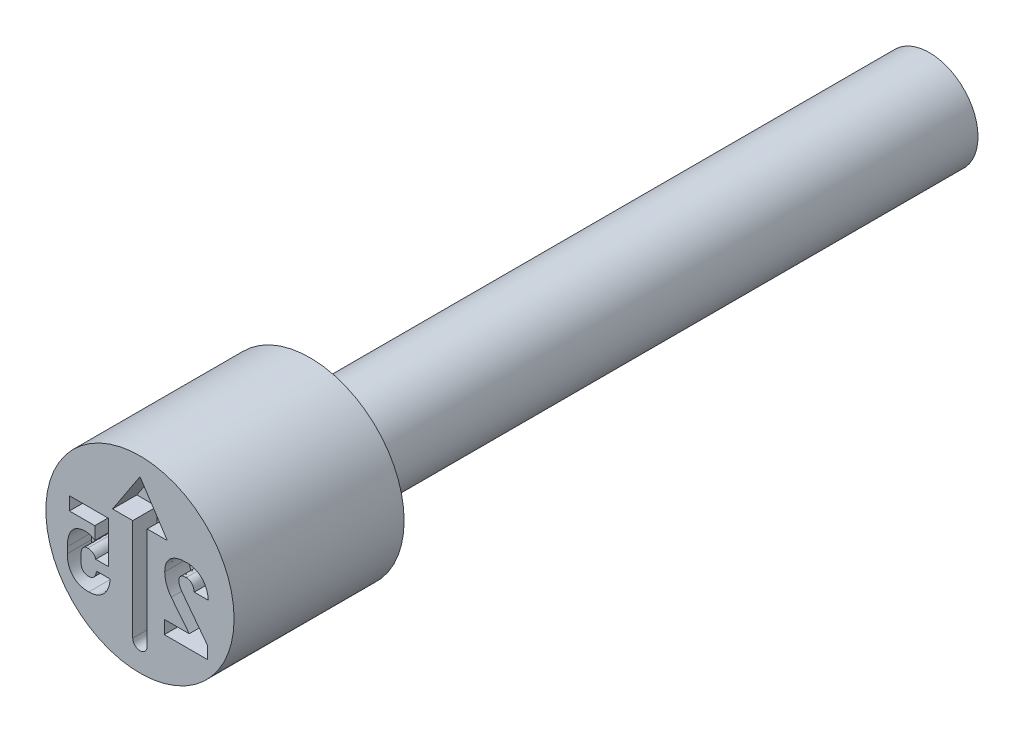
SolidWorks part; units mm, degrees
ref_plane "Front Plane" through (0, 0, 0) normal (0, 0, 1) x (1, 0, 0)
ref_plane "Top Plane" through (0, 0, 0) normal (0, 1, 0) x (1, 0, 0)
ref_plane "Right Plane" through (0, 0, 0) normal (1, 0, 0) x (0, 0, -1)
sketch "Sketch2" plane through (0, 0, 0) normal (1, 0, 0) x (0, 0, -1)
  line L0 (0.4039, 0) -> (50000.4039, 0) construction
  line L6 (0, 1.55) -> (0, 0)
  line L7 (2.8, 1.55) -> (0, 1.55)
  line L8 (2.8, 0.8) -> (2.8, 1.55)
  line L9 (13, 0.8) -> (2.8, 0.8)
  line L10 (13, 0) -> (13, 0.8)
  line L11 (0, 0) -> (13, 0)
  dimension "D1" = 3.1
  dimension "D2" = 1.6
  dimension "D3" = 13
  dimension "D4" = 2.8
revolve "Revolve1" add sketch "Sketch2" angle 360 about L0
sketch "Sketch3" plane through (0, 0, 0) normal (0, 0, 1) x (1, 0, 0)
  line L0 (0, 0) -> (0, 62500) construction
  line L1 (0.119, 0.5665) -> (0.119, -1.1101)
  line L2 (0.4512, 0.5665) -> (0.119, 0.5665)
  line L3 (0, 1.2513) -> (0.4512, 0.5665)
  line L15 (0, 1.2513) -> (-0.4512, 0.5665)
  line L16 (-0.4512, 0.5665) -> (-0.119, 0.5665)
  line L17 (-0.119, 0.5665) -> (-0.119, -1.1101)
  arc A2 (-0.119, -1.1101) -> (0.119, -1.1101) centre (0, -1.1101) ccw
extrude "Cut-Extrude4" cut sketch "Sketch3" against normal blind 0.4
sketch "Sketch4" plane through (0, 0, 0) normal (0, 0, 1) x (1, 0, 0)
  text T0 "2  5" font "Bahnschrift" height 1.2
  dimension "D1" = 0.8
  dimension "D2" = 1.2
extrude "Cut-Extrude5" cut sketch "Sketch4" against normal blind 0.4
